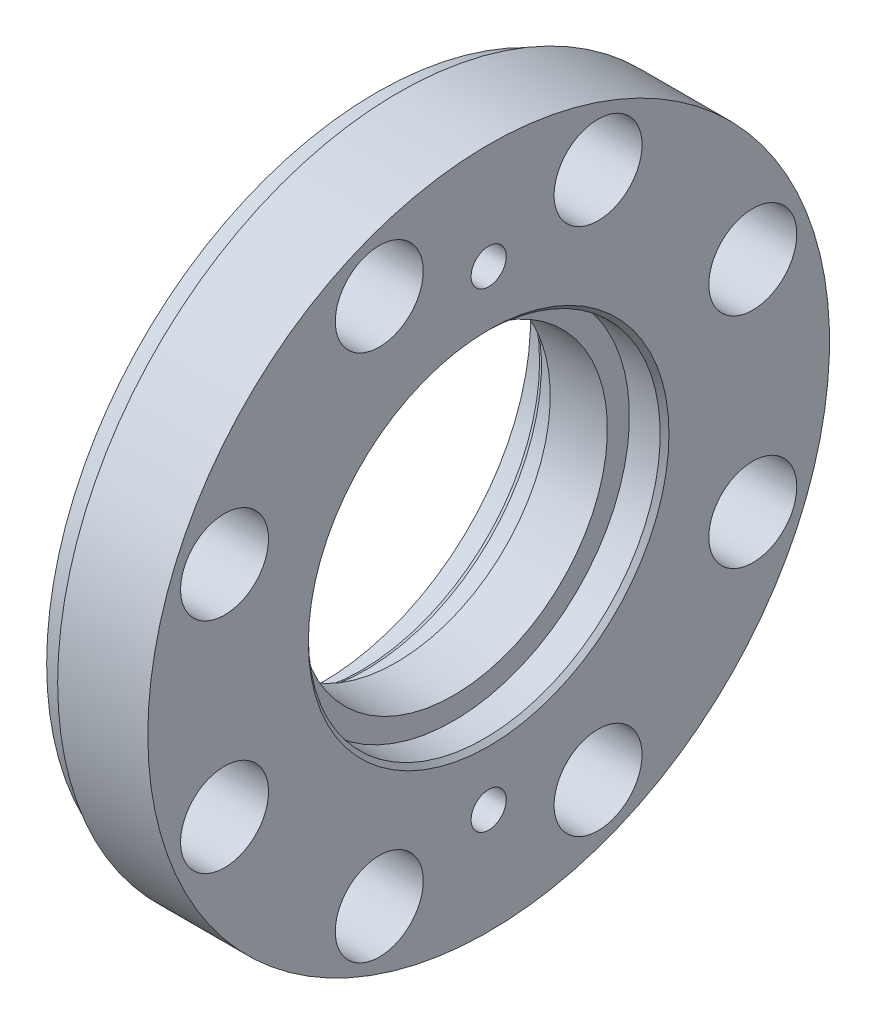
SolidWorks part; units mm, degrees
ref_plane "Plan de face" through (0, 0, 0) normal (0, 0, 1) x (1, 0, 0)
ref_plane "Plan de dessus" through (0, 0, 0) normal (0, 1, 0) x (1, 0, 0)
ref_plane "Plan de droite" through (0, 0, 0) normal (1, 0, 0) x (0, 0, -1)
sketch "Esquisse1" plane through (0, 0, 0) normal (0, 0, 1) x (1, 0, 0)
  line L0 (0, 0) -> (50.3032, 0) construction
  line L1 (0, 0) -> (0, 55)
  line L2 (0, 55) -> (3, 55)
  line L3 (3, 55) -> (3, 51.9)
  line L4 (3, 51.9) -> (7.8, 51.9)
  line L5 (7.8, 51.9) -> (7.8, 55)
  line L6 (7.8, 55) -> (12.5, 55)
  line L7 (12.5, 55) -> (12.5, 75)
  line L8 (12.5, 75) -> (17.5, 75)
  line L9 (17.5, 75) -> (17.5, 77.5)
  line L10 (17.5, 77.5) -> (38, 77.5)
  line L11 (38, 77.5) -> (38, 0)
  line L12 (38, 0) -> (0, 0)
  dimension "D1" = 38
  dimension "D2" = 77.5
  dimension "D3" = 75
  dimension "D4" = 51.9
  dimension "D5" = 55
  dimension "D6" = 3
  dimension "D7" = 4.8
  dimension "D8" = 12.5
  dimension "D9" = 5
revolve "Révolution1" add sketch "Esquisse1" angle 360 about L0
chamfer "Chanfrein1" distance 2 angle 45 1 edges at (0, 0, 55)
sketch "Esquisse2" plane through (0, 0, 0) normal (0, 0, 1) x (1, 0, 0)
  line L0 (0, 0) -> (70.0804, 0) construction
  line L1 (0, 0) -> (0, 47.5)
  line L2 (0, 53) -> (0, -53) construction
  line L3 (0, 47.5) -> (9, 47.5)
  line L4 (9, 47.5) -> (9, 40)
  line L5 (9, 40) -> (17, 40)
  line L6 (17, 40) -> (17, 35)
  line L7 (17, 35) -> (30, 35)
  line L8 (30, 35) -> (30, 40)
  line L9 (30, 40) -> (38, 40)
  line L10 (38, -77.5) -> (38, 77.5) construction
  line L11 (38, 40) -> (38, 0)
  line L12 (38, 0) -> (0, 0)
  dimension "D1" = 47.5
  dimension "D2" = 40
  dimension "D3" = 35
  dimension "D4" = 40
  dimension "D5" = 8
  dimension "D6" = 9
  dimension "D7" = 8
revolve "Enlèvement de matière-Révolution1" cut sketch "Esquisse2" angle 360 about L0
chamfer "Chanfrein2" distance 1 angle 30 1 edges at (9, 0, 40)
chamfer "Chanfrein3" distance 1 angle 45 1 edges at (38, 0, 40)
hole_wizard "Chambrage pour vis à tête ronde bombée M51" positions "Esquisse4" profile "Esquisse3" counterbore size "M5" standard "Ansi Métrique"
sketch "Esquisse4" plane through (38, 0, 0) normal (1, 0, 0) x (0, 0, -1)
  line L0 (0, 0) -> (35.0202, 84.5464) construction
  line L2 (0, 0) -> (0, 87.742) construction
  point P0 (24.8744, 60.0522)
  dimension "D1" = 22.5
  dimension "D2" = 65
sketch "Esquisse3" plane through (38, 60.0522, -24.8744) normal (0, 1, 0) x (0, 0, -1)
  line L0 (0, 0) -> (0, 38)
  line L1 (0, 38) -> (6.5, 38)
  line L3 (6.5, 38) -> (6.5, 16)
  line L4 (6.5, 16) -> (10, 16)
  line L5 (10, 16) -> (10, 0)
  line L7 (10, 0) -> (0, 0)
  line L11 (0, -6.35) -> (0, 107.95) construction
  dimension "Diamètre du perçage jusqu'au prochain" = 13
  dimension "Profondeur du perçage jusqu'au prochain" = 38
  dimension "Diamètre du chambrage" = 20
  dimension "Profondeur du chambrage" = 16
pattern_circular "Répétition circulaire1" count 8 every 45 about axis through (0, 0, 0) along (1, 0, 0) of "Chambrage pour vis à tête ronde bombée M51"
hole_wizard "Trou taraudé M10x1.51" positions "Esquisse6" profile "Esquisse5" tap size "M10x1.5" standard "Ansi Métrique"
sketch "Esquisse6" plane through (38, 0, 0) normal (1, 0, 0) x (0, 0, -1)
  line L0 (0, 0) -> (0, 53.5) construction
  point P0 (0, 53.5)
  dimension "D1" = 53.5
sketch "Esquisse5" plane through (38, 53.5, 0) normal (0, 1, 0) x (0, 0, -1)
  line L0 (0, 0) -> (0, 25.4034)
  line L1 (0, 25.4034) -> (4, 23)
  line L2 (4, 23) -> (4, 0)
  line L5 (4, 0) -> (0, 0)
  line L10 (0, 25.4034) -> (-4, 23) construction
  line L11 (0, -6.35) -> (0, 107.95) construction
  dimension "Diamètre du trou pour taraudage" = 8
  dimension "Profondeur du trou pour taraudage" = 23
  dimension "Angle de pointe" = 118
pattern_circular "Répétition circulaire2" count 2 every 180 about axis through (0, 0, 0) along (1, 0, 0) of "Trou taraudé M10x1.51"
